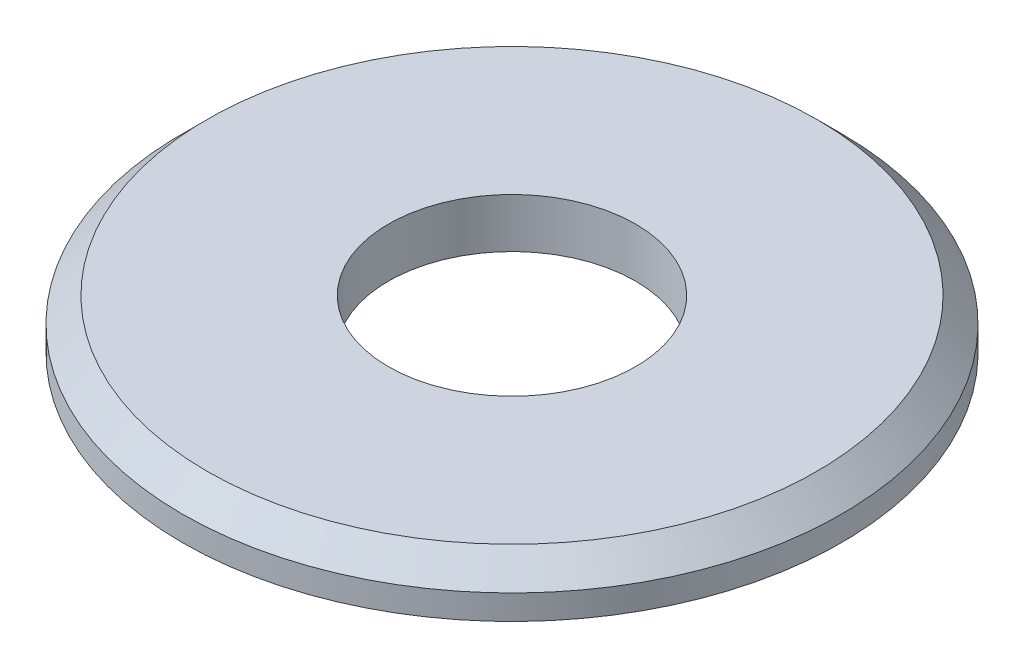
SolidWorks part; units mm, degrees
ref_plane "Front" through (0, 0, 0) normal (0, 0, 1) x (1, 0, 0)
ref_plane "Top" through (0, 0, 0) normal (0, 1, 0) x (1, 0, 0)
ref_plane "Right" through (0, 0, 0) normal (1, 0, 0) x (0, 0, -1)
sketch "Sketch1" plane through (0, 0, 0) normal (0, 1, 0) x (1, 0, 0)
  circle A0 centre (0, 0) radius 0.75
  circle A1 centre (0, 0) radius 2
extrude "Extrude1" add sketch "Sketch1" along normal blind 0.3
chamfer "Chamfer1" distance 0.15 1 edges at (0, 0.3, 2)
